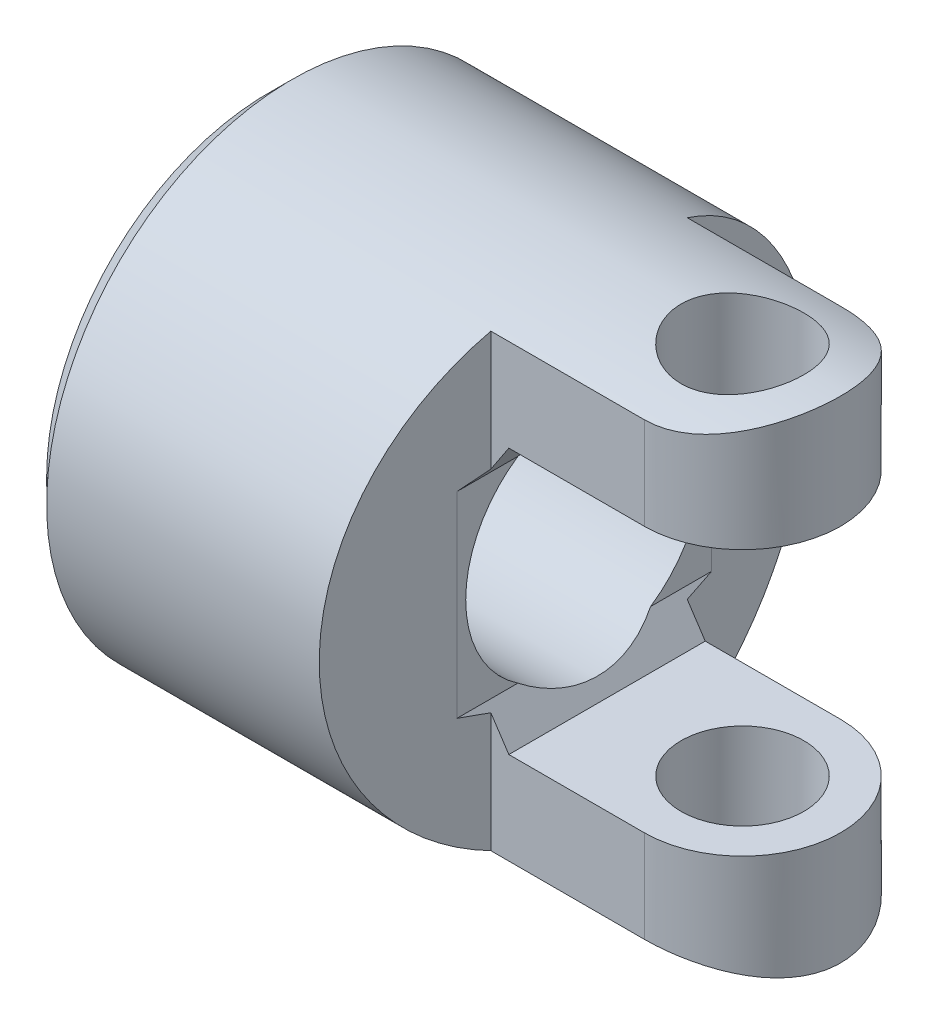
SolidWorks part; units mm, degrees
ref_plane "Ebene vorne" through (0, 0, 0) normal (0, 0, 1) x (1, 0, 0)
ref_plane "Ebene oben" through (0, 0, 0) normal (0, 1, 0) x (1, 0, 0)
ref_plane "Ebene rechts" through (0, 0, 0) normal (1, 0, 0) x (0, 0, -1)
imported_body "Oberfläche-Importiert1"
surface "Oberfläche-Verlängern1" parameters "D1"=9.6, "D2"=9.6
surface "Oberfläche-Ebene2"
surface "Oberfläche-Trimmen1"
surface "Oberfläche-Trimmen3"
surface "Oberfläche-Ebene4"
surface "Oberfläche-Ebene5"
surface "Oberfläche-Zusammenfügen1"
mirror "Spiegeln1" about plane through (18.6527, 0, -14.5) normal (0, -1, 0)
